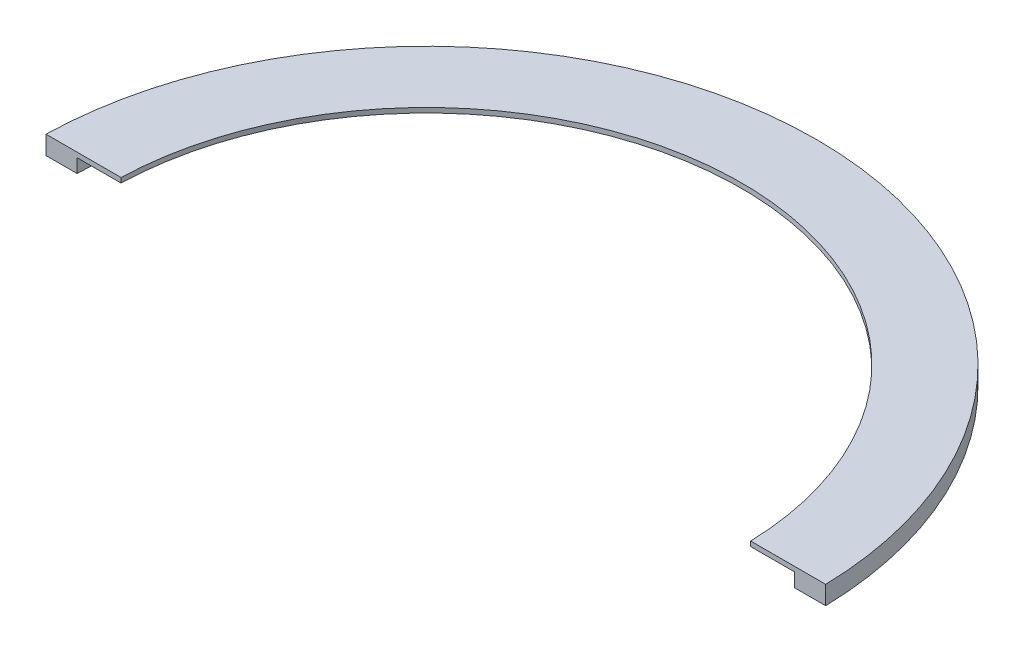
SolidWorks part; units mm, degrees
ref_plane "Front Plane" through (0, 0, 0) normal (0, 0, 1) x (1, 0, 0)
ref_plane "Top Plane" through (0, 0, 0) normal (0, 1, 0) x (1, 0, 0)
ref_plane "Right Plane" through (0, 0, 0) normal (1, 0, 0) x (0, 0, -1)
sketch "Sketch1" plane through (0, 0, 0) normal (0, 0, 1) x (1, 0, 0)
  line L0 (-107.696, 1.651) -> (-133.35, 1.651)
  line L1 (-133.35, 1.651) -> (-133.35, -4.699)
  line L2 (-133.35, -4.699) -> (-122.7582, -4.699)
  line L3 (-122.7582, -4.699) -> (-122.7582, 0)
  line L4 (-122.7582, 0) -> (-107.696, 0)
  line L5 (-107.696, 0) -> (-107.696, 1.651)
  line L6 (0, 0) -> (0, 74.3943) construction
  dimension "D1" = 1.651
  dimension "D2" = 266.7
  dimension "D3" = 6.35
  dimension "D4" = 245.5164
  dimension "D5" = 215.392
revolve "Revolve1" add sketch "Sketch1" angle 360 about L6
sketch "Sketch2" plane through (0, 1.651, 0) normal (0, 1, 0) x (1, 0, 0)
  line L0 (0, 0) -> (0, -46.0246) construction
  line L1 (135.89, -133.35) -> (-135.89, -133.35)
  line L2 (135.89, -133.35) -> (135.89, 3.175)
  line L3 (135.89, 3.175) -> (-135.89, 3.175)
  line L4 (-135.89, -133.35) -> (-135.89, 3.175)
  circle A0 centre (0, 0) radius 133.35 construction
  dimension "D2" = 2.54
  dimension "D1" = 3.175
extrude "Cut-Extrude1" cut sketch "Sketch2" against normal up to next
